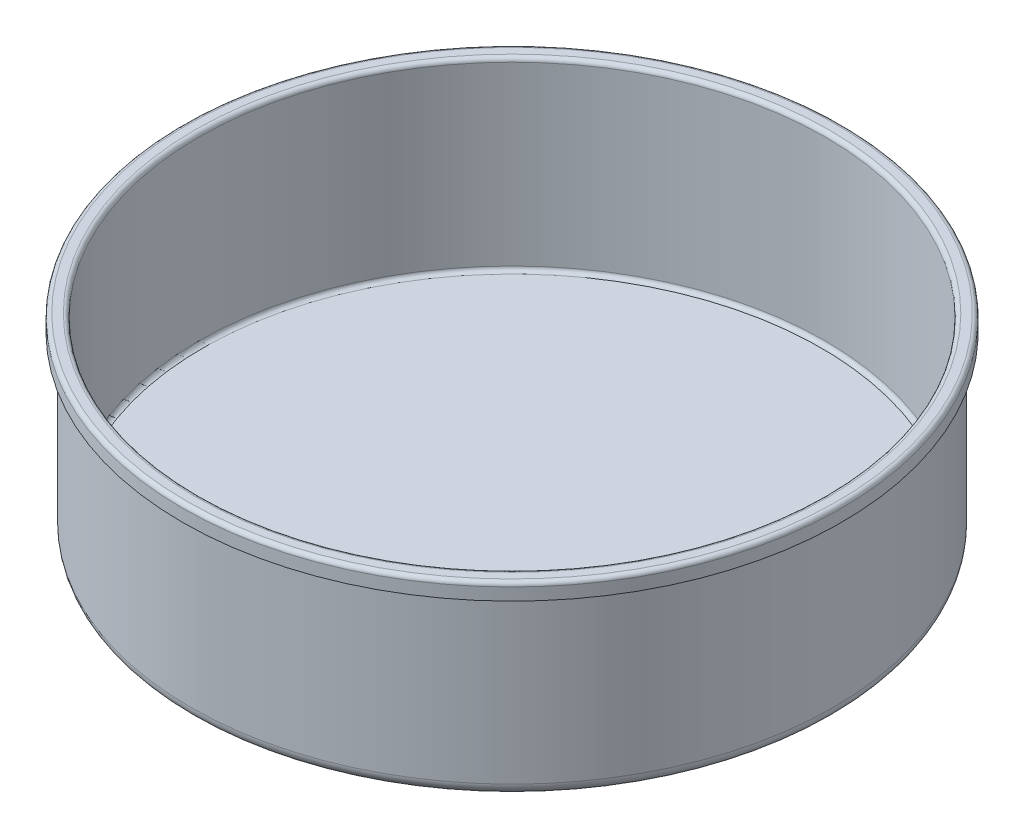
SolidWorks part; units mm, degrees
ref_plane "Front Plane" through (0, 0, 0) normal (0, 0, 1) x (1, 0, 0)
ref_plane "Top Plane" through (0, 0, 0) normal (0, 1, 0) x (1, 0, 0)
ref_plane "Right Plane" through (0, 0, 0) normal (1, 0, 0) x (0, 0, -1)
sketch "Sketch1" plane through (0, 0, 0) normal (0, 1, 0) x (1, 0, 0)
  circle A0 centre (0, 0) radius 100
  dimension "D1" = 200
extrude "Boss-Extrude1" add sketch "Sketch1" along normal blind 60
fillet "Fillet1" radius 3.81
shell "Shell1" thickness 2.54
sketch "Sketch2" plane through (0, 60, 0) normal (0, 1, 0) x (1, 0, 0)
  circle A2 centre (0, 0) radius 102.54
  circle A3 centre (0, 0) radius 102.54
  circle A5 centre (0, 0) radius 97.46 construction
  circle A6 centre (0, 0) radius 97.46
  dimension "D1" = 2.54
extrude "Boss-Extrude2" add sketch "Sketch2" against normal blind 5.08
fillet "Fillet2" radius 1.27
